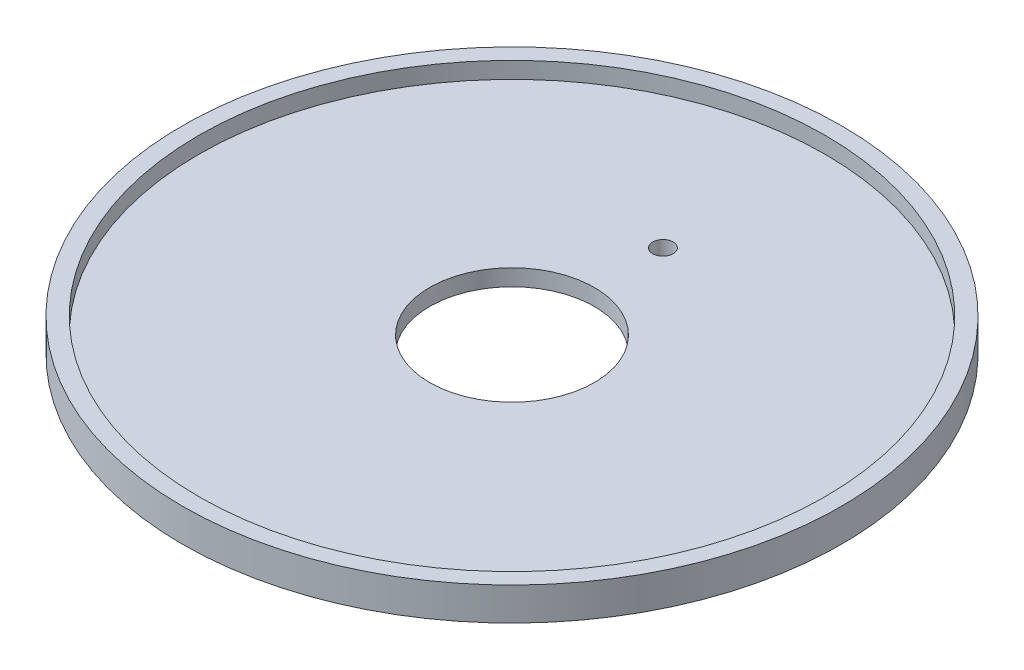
SolidWorks part; units mm, degrees
ref_plane "Front Plane" through (0, 0, 0) normal (0, 0, 1) x (1, 0, 0)
ref_plane "Top Plane" through (0, 0, 0) normal (0, 1, 0) x (1, 0, 0)
ref_plane "Right Plane" through (0, 0, 0) normal (1, 0, 0) x (0, 0, -1)
sketch "Sketch1" plane through (0, 0, 0) normal (0, 1, 0) x (1, 0, 0)
  circle A0 centre (0, 0) radius 100
  circle A1 centre (0, 0) radius 25
  dimension "D1" = 200
  dimension "D2" = 50
extrude "Boss-Extrude1" add sketch "Sketch1" along normal blind 5
sketch "Sketch7" plane through (0, 5, 0) normal (0, 1, 0) x (1, 0, 0)
  circle A0 centre (0, 0) radius 95
  circle A1 centre (0, 0) radius 100
  dimension "D1" = 190
  dimension "D2" = 200
extrude "Boss-Extrude3" add sketch "Sketch7" along normal blind 5
sketch "Sketch3" plane through (0, 5, 0) normal (0, 1, 0) x (1, 0, 0)
  circle A0 centre (0, 0) radius 95
  circle A1 centre (0, 0) radius 25
  dimension "D1" = 190
  dimension "D2" = 50
sketch "Sketch6" plane through (0, 5, 0) normal (0, 1, 0) x (1, 0, 0)
  circle A1 centre (0, 45.8) radius 3.1014
  dimension "D1" = 45.8
extrude "Cut-Extrude1" cut sketch "Sketch6" against normal blind 10
